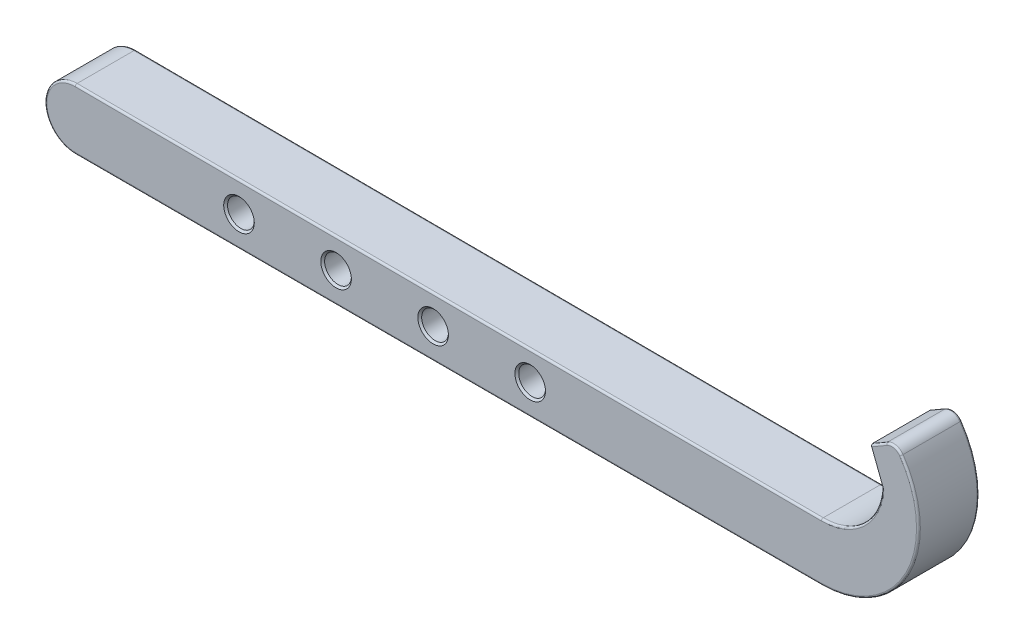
SolidWorks part; units mm, degrees
ref_plane "Front Plane" through (0, 0, 0) normal (0, 0, 1) x (1, 0, 0)
ref_plane "Top Plane" through (0, 0, 0) normal (0, 1, 0) x (1, 0, 0)
ref_plane "Right Plane" through (0, 0, 0) normal (1, 0, 0) x (0, 0, -1)
sketch "Sketch1" plane through (0, 0, 0) normal (0, 0, 1) x (1, 0, 0)
  line L0 (-111.6698, 0) -> (83.5902, 0) construction
  line L1 (-111.6698, 7.94) -> (83.5902, 7.1524)
  line L2 (-111.6698, -7.94) -> (83.5902, -7.94)
  line L3 (83.5902, -7.94) -> (83.5902, 17.46) construction
  line L4 (83.5902, 7.1524) -> (83.5902, 23.0324) construction
  line L5 (133.2019, 23.0324) -> (83.5902, 23.0324) construction
  line L6 (83.5902, 23.0324) -> (102.7737, 34.1079) construction
  line L7 (83.5902, 23.0324) -> (96.5806, 30.5324) construction
  line L8 (99.4702, 23.0324) -> (96.5806, 30.5324)
  line L9 (96.5806, 30.5324) -> (100.5117, 32.802)
  line L10 (108.9902, 37.6971) -> (121.1587, 44.7225) construction
  arc A0 (-111.6698, 7.94) -> (-111.6698, -7.94) centre (-111.6698, 0) ccw
  arc A1 (83.5902, -7.94) -> (104.4789, 31.9107) centre (83.5902, 17.46) ccw
  arc A2 (83.5902, 7.1524) -> (99.4702, 23.0324) centre (83.5902, 23.0324) ccw
  arc A3 (104.4789, 31.9107) -> (100.5117, 32.802) centre (102.0117, 30.2039) ccw
  circle A4 centre (-68.8098, 0) radius 3.5
  circle A5 centre (-43.4098, 0) radius 3.5
  circle A6 centre (-18.0098, 0) radius 3.5
  circle A7 centre (7.3902, 0) radius 3.5
  point P3 (-14.0398, 0)
  dimension "D2" = 7.94
  dimension "D3" = 30
  dimension "D4" = 3
  dimension "D6" = 15.88
  dimension "D5" = 15
  dimension "D7" = 25.4
  dimension "D8" = 7
  dimension "D9" = 42.86
  dimension "D11" = 152.4
  dimension "D12" = 25.4
  dimension "D13" = 50.8
  dimension "D10" = 4
extrude "Boss-Extrude1" add sketch "Sketch1" along normal mid plane 15.875
chamfer "Chamfer1" distance 0.5 angle 45 2 edges at (-65.3098, 0, -7.9375) (-65.3098, 0, 7.9375)
chamfer "Chamfer2" distance 0.5 angle 45 2 edges at (-39.9098, 0, -7.9375) (-39.9098, 0, 7.9375)
chamfer "Chamfer3" distance 0.5 angle 45 2 edges at (-14.5098, 0, -7.9375) (-14.5098, 0, 7.9375)
chamfer "Chamfer4" distance 0.5 angle 45 2 edges at (10.8902, 0, -7.9375) (10.8902, 0, 7.9375)
fillet "Fillet1" radius 0.5 14 edges at (94.8191, 11.8035, -7.9375) (98.5462, 31.6672, -7.9375) (102.6694, 33.131, -7.9375) (106.087, 5.6678, -7.9375) (-14.0398, -7.94, -7.9375) (-119.6098, 0, -7.9375) (94.8191, 11.8035, 7.9375) (98.5462, 31.6672, 7.9375) (102.6694, 33.131, 7.9375) (106.087, 5.6678, 7.9375) (-14.0398, -7.94, 7.9375) (-119.6098, 0, 7.9375) (-14.0398, 7.5462, -7.9375) (-14.0398, 7.5462, 7.9375)
